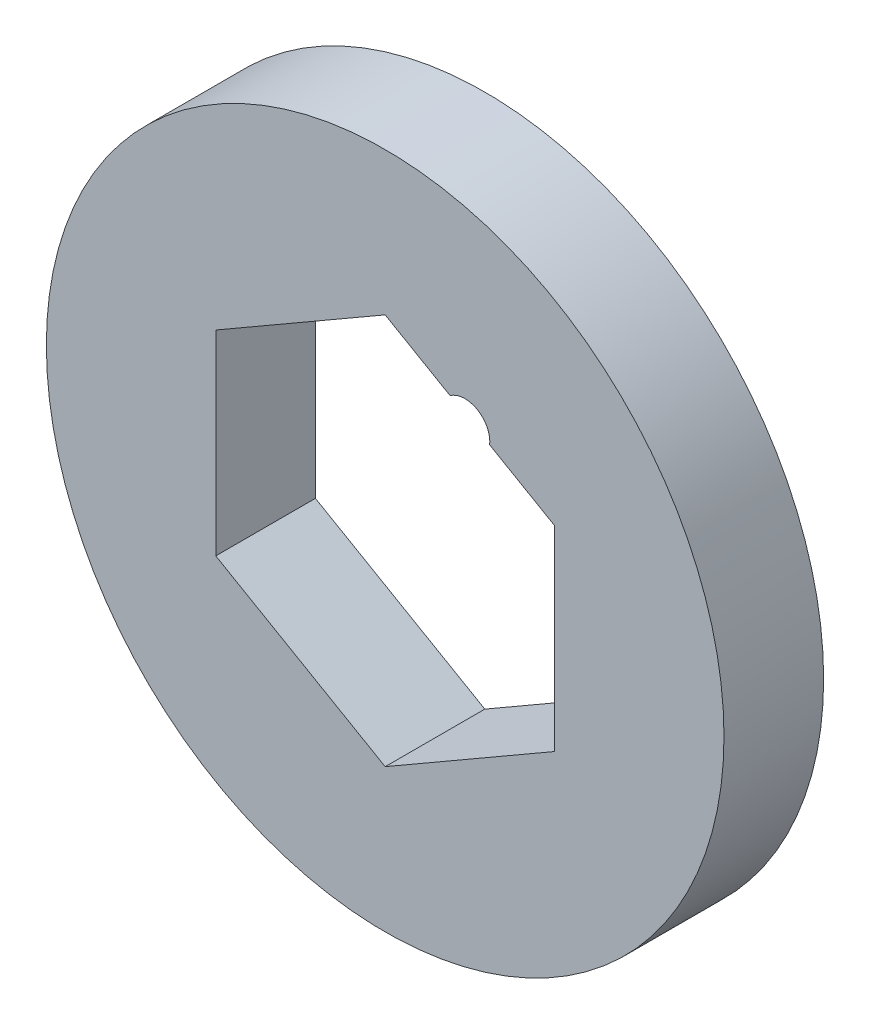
SolidWorks part; units mm, degrees
ref_plane "Plan de face" through (0, 0, 0) normal (0, 0, 1) x (1, 0, 0)
ref_plane "Plan de dessus" through (0, 0, 0) normal (0, 1, 0) x (1, 0, 0)
ref_plane "Plan de droite" through (0, 0, 0) normal (1, 0, 0) x (0, 0, -1)
sketch "Esquisse1" plane through (0, 0, 0) normal (0, 0, 1) x (1, 0, 0)
  line L1 (0, 9.815) -> (-8.5, 4.9075)
  line L2 (-8.5, 4.9075) -> (-8.5, -4.9075)
  line L3 (-8.5, -4.9075) -> (0, -9.815)
  line L4 (0, -9.815) -> (8.5, -4.9075)
  line L5 (8.5, -4.9075) -> (8.5, 4.9075)
  line L6 (8.5, 4.9075) -> (0, 9.815)
  circle A0 centre (0, 0) radius 17
  circle A1 centre (0, 0) radius 8.5 construction
  dimension "D1" = 34
  dimension "D2" = 17
extrude "Extrusion1" add sketch "Esquisse1" along normal blind 5
sketch "Esquisse2" plane through (0, 0, 5) normal (0, 0, 1) x (1, 0, 0)
  line L0 (0, 0) -> (4.25, 7.3612) construction
  line L1 (8.5, 4.9075) -> (0, 9.815) construction
  circle A0 centre (4, 6.9282) radius 1.25
  dimension "D1" = 2.5
  dimension "D2" = 0.5
extrude "Enlèv. mat.-Extru.1" cut sketch "Esquisse2" against normal through all
